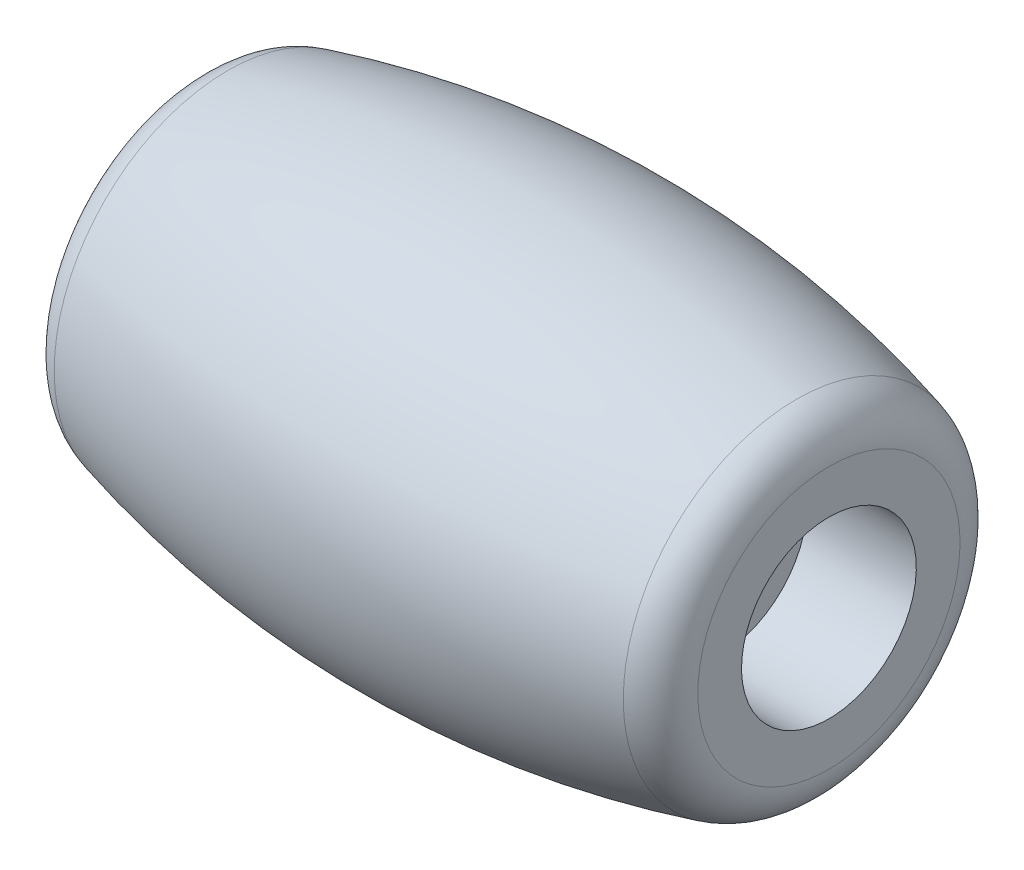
SolidWorks part; units mm, degrees
ref_plane "Alzado" through (0, 0, 0) normal (0, 0, 1) x (1, 0, 0)
ref_plane "Planta" through (0, 0, 0) normal (0, 1, 0) x (1, 0, 0)
ref_plane "Vista lateral" through (0, 0, 0) normal (1, 0, 0) x (0, 0, -1)
sketch "Croquis1" plane through (0, 0, 0) normal (0, 0, 1) x (1, 0, 0)
  line L0 (5, -3.5) -> (5, -5)
  line L1 (5, -5) -> (24, -5)
  line L2 (24, -5) -> (24, -3.5)
  line L3 (24, -3.5) -> (29, -3.5)
  line L4 (29, -3.5) -> (29, -1.5)
  line L5 (0, -1.5) -> (0, -3.5)
  line L6 (0, -3.5) -> (5, -3.5)
  line L7 (-0.0013, -7.5) -> (29.0013, -7.5) construction
  arc A0 (29, -1.5) -> (27.5208, 0.431) centre (27, -1.5) ccw
  arc A1 (27.5208, 0.431) -> (1.4792, 0.431) centre (14.5, -47.8438) ccw
  arc A2 (1.4792, 0.431) -> (0, -1.5) centre (2, -1.5) ccw
  dimension "D9" = 50
  dimension "D12" = 2
  dimension "D1" = 19
  dimension "D2" = 7.5
  dimension "D3" = 5
  dimension "D4" = 1.5
  dimension "D5" = 29
  dimension "D6" = 5
  dimension "D7" = 2
  dimension "D8" = 2
  dimension "D10" = 47.8438
  dimension "D11" = 14.5
revolve "Revolución1" add sketch "Croquis1" angle 360 about L7
